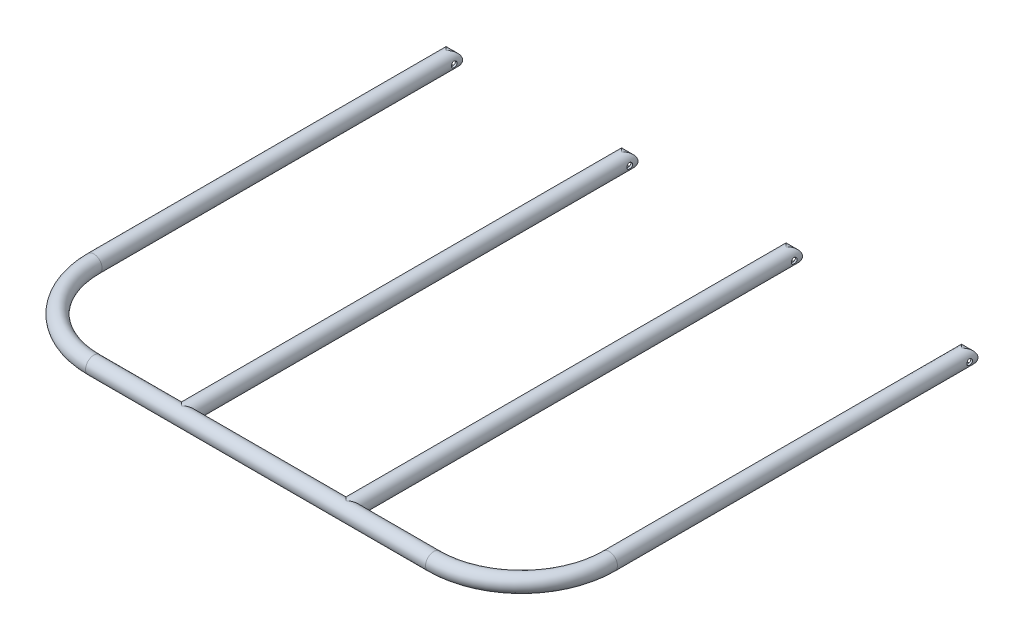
SolidWorks part; units mm, degrees
ref_plane "Front Plane" through (0, 0, 0) normal (0, 0, 1) x (1, 0, 0)
ref_plane "Top Plane" through (0, 0, 0) normal (0, 1, 0) x (1, 0, 0)
ref_plane "Right Plane" through (0, 0, 0) normal (1, 0, 0) x (0, 0, -1)
sketch "Sketch1" plane through (0, 0, 0) normal (0, 1, 0) x (1, 0, 0)
  line L0 (-298.45, 0) -> (-298.45, -419.1)
  line L1 (-196.85, -520.7) -> (196.85, -520.7)
  line L2 (298.45, -419.1) -> (298.45, 0)
  line L3 (-298.45, 0) -> (298.45, 0) construction
  line L4 (-95.25, 0) -> (-95.25, -520.7)
  line L5 (95.25, 0) -> (95.25, -520.7)
  line L6 (0, 0) -> (0, -270) construction
  arc A0 (-298.45, -419.1) -> (-196.85, -520.7) centre (-196.85, -419.1) ccw
  arc A1 (196.85, -520.7) -> (298.45, -419.1) centre (196.85, -419.1) ccw
  dimension "D3" = 101.6
  dimension "D1" = 596.9
  dimension "D2" = 520.7
  dimension "D4" = 190.5
other "Al round tubing 0.75 OD X 0.083 WALL(1)"
ref_plane "Plane3" through (-298.45, 0, 0) normal (0, 0, 1) x (1, 0, 0)
sketch "Sketch18" plane through (-298.45, 0, 0) normal (0, 0, 1) x (1, 0, 0)
  circle A0 centre (0, 0) radius 7.4168
  circle A1 centre (0, 0) radius 9.525
  point P3 (0, 0)
  dimension "In_dia" = 14.8336
  dimension "Out_dia" = 19.05
sketch "Sketch12" plane through (0, 0, 0) normal (1, 0, 0) x (0, 0, -1)
  line L0 (0, 50) -> (0, -50) construction
  line L1 (0, 0) -> (-520.7, 0) construction
  circle A0 centre (-11.1125, 0) radius 3.2639
  dimension "D1" = 6.5278
  dimension "D2" = 11.1125
extrude "Cut-Extrude1" cut sketch "Sketch12" against normal through all and the other way through all
ref_plane "Plane2" through (-298.45, 0, 0) normal (1, 0, 0) x (0, 0, -1)
sketch "Sketch14" plane through (0, 0, 0) normal (1, 0, 0) x (0, 0, -1)
  line L0 (-50, 9.525) -> (-11.1125, 9.525)
  line L1 (-11.1125, -9.525) -> (-60, -9.525)
  line L4 (0, 9.525) -> (-419.1, 9.525) construction
  line L5 (-419.1, -9.525) -> (0, -9.525) construction
  arc A0 (-11.1125, 9.525) -> (-11.1125, -9.525) centre (-11.1125, 0) cw
  circle A2 centre (-11.1125, 0) radius 3.2639 construction
extrude "Cut-Extrude2" cut sketch "Sketch14" against normal through all and the other way through all
